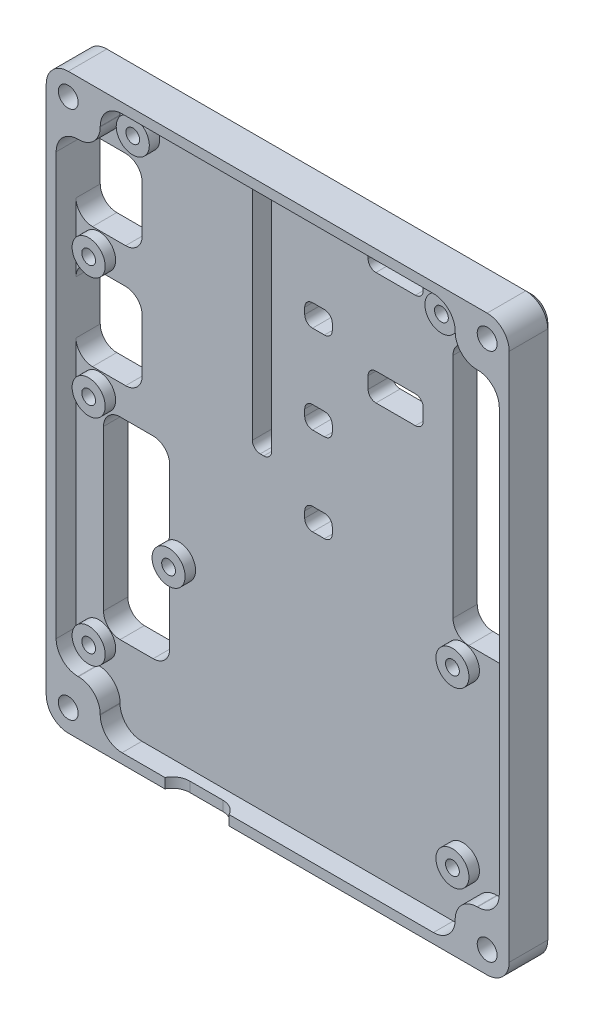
SolidWorks part; units mm, degrees
ref_plane "前视基准面" through (0, 0, 0) normal (0, 0, 1) x (1, 0, 0)
ref_plane "上视基准面" through (0, 0, 0) normal (0, 1, 0) x (1, 0, 0)
ref_plane "右视基准面" through (0, 0, 0) normal (1, 0, 0) x (0, 0, -1)
other "Configuration Table"
sketch "草图1" plane through (0, 0, 0) normal (0, 0, 1) x (1, 0, 0)
  line L1 (0, 0) -> (84, 0)
  line L2 (0, 0) -> (0, 104)
  line L3 (0, 104) -> (84, 104)
  line L4 (84, 0) -> (84, 104)
  dimension "D1" = 104
  dimension "D2" = 84
extrude "凸台-拉伸1" add sketch "草图1" along normal blind 8
fillet "圆角1" radius 4 4 edges at (84, 0, 4) (0, 0, 4) (0, 104, 4) (84, 104, 4)
sketch "草图2" plane through (0, 0, 8) normal (0, 0, 1) x (1, 0, 0)
  line L0 (0, 100) -> (0, 4) construction
  line L1 (4, 100) -> (80, 100) construction
  line L2 (4, 100) -> (4, 4) construction
  line L3 (4, 4) -> (80, 4) construction
  line L4 (80, 100) -> (80, 4) construction
  line L5 (4, 0) -> (80, 0) construction
  line L6 (84, 4) -> (84, 100) construction
  line L7 (80, 104) -> (4, 104) construction
  circle A0 centre (4, 100) radius 1.8
  circle A1 centre (80, 100) radius 1.8
  circle A2 centre (80, 4) radius 1.8
  circle A3 centre (4, 4) radius 1.8
  dimension "D1" = 3.6
  dimension "D2" = 3.6
  dimension "D3" = 3.6
  dimension "D4" = 3.6
  dimension "D5" = 4
  dimension "D6" = 4
  dimension "D7" = 4
  dimension "D8" = 4
  dimension "D9" = 96
  dimension "D10" = 76
extrude "切除-拉伸1" cut sketch "草图2" against normal through all
sketch "草图3" plane through (0, 0, 8) normal (0, 0, 1) x (1, 0, 0)
  line L0 (0, 100) -> (0, 4) construction
  line L1 (2, 2) -> (82, 2) construction
  line L2 (2, 2) -> (2, 102) construction
  line L3 (2, 102) -> (82, 102) construction
  line L4 (82, 2) -> (82, 102) construction
  line L5 (4, 0) -> (80, 0) construction
  circle A0 centre (6, 14) radius 1.25
  circle A1 centre (6, 53) radius 1.25
  circle A2 centre (6, 75) radius 1.25
  circle A3 centre (14, 98) radius 1.25
  circle A4 centre (70, 98) radius 1.25
  circle A5 centre (72, 43.5) radius 1.25
  circle A6 centre (72, 12) radius 1.25
  circle A7 centre (20.5, 33.5) radius 1.25
  dimension "D19" = 2.5
  dimension "D20" = 2.5
  dimension "D21" = 2.5
  dimension "D22" = 2.5
  dimension "D23" = 2.5
  dimension "D24" = 2.5
  dimension "D25" = 2.5
  dimension "D28" = 2.5
  dimension "D1" = 2
  dimension "D2" = 80
  dimension "D3" = 100
  dimension "D4" = 2
  dimension "D5" = 4
  dimension "D6" = 12
  dimension "D7" = 4
  dimension "D8" = 51
  dimension "D9" = 12
  dimension "D10" = 96
  dimension "D11" = 4
  dimension "D12" = 73
  dimension "D13" = 96
  dimension "D14" = 68
  dimension "D15" = 70
  dimension "D16" = 41.5
  dimension "D17" = 70
  dimension "D18" = 10
  dimension "D26" = 18.5
  dimension "D27" = 31.5
extrude "切除-拉伸2" cut sketch "草图3" against normal blind 7
chamfer "倒角1" distance 1 angle 45 8 edges at (82.8284, 1.1716, 0) (42, 0, 0) (1.1716, 1.1716, 0) (0, 52, 0) (1.1716, 102.8284, 0) (42, 104, 0) (84, 52, 0) (82.8284, 102.8284, 0)
sketch "草图5" plane through (0, 0, 8) normal (0, 0, 1) x (1, 0, 0)
  line L0 (0, 100) -> (0, 4) construction
  line L1 (13.75, 1.8) -> (70.25, 1.8)
  line L2 (1.8, 13.75) -> (1.8, 90.25)
  line L3 (13.75, 102.2) -> (70.25, 102.2)
  line L4 (82.2, 13.75) -> (82.2, 90.25)
  line L5 (84, 4) -> (84, 100) construction
  line L6 (80, 104) -> (4, 104) construction
  line L7 (4, 0) -> (80, 0) construction
  line L8 (78.15, 94.2) -> (78.25, 94.2)
  line L9 (5.75, 9.8) -> (5.85, 9.8)
  line L10 (9.8, 5.75) -> (9.8, 5.85)
  line L11 (5.75, 94.2) -> (5.85, 94.2)
  line L12 (74.2, 5.75) -> (74.2, 5.85)
  line L13 (9.8, 98.15) -> (9.8, 98.25)
  line L14 (74.2, 98.15) -> (74.2, 98.25)
  line L15 (78.15, 9.8) -> (78.25, 9.8)
  arc A0 (1.8, 13.75) -> (5.75, 9.8) centre (5.75, 13.75) ccw
  arc A1 (5.85, 9.8) -> (9.8, 5.85) centre (5.85, 5.85) cw
  arc A2 (9.8, 5.75) -> (13.75, 1.8) centre (13.75, 5.75) ccw
  arc A3 (70.25, 1.8) -> (74.2, 5.75) centre (70.25, 5.75) ccw
  arc A4 (74.2, 5.85) -> (78.15, 9.8) centre (78.15, 5.85) cw
  arc A5 (78.25, 9.8) -> (82.2, 13.75) centre (78.25, 13.75) ccw
  arc A6 (82.2, 90.25) -> (78.25, 94.2) centre (78.25, 90.25) ccw
  arc A7 (78.15, 94.2) -> (74.2, 98.15) centre (78.15, 98.15) cw
  arc A8 (74.2, 98.25) -> (70.25, 102.2) centre (70.25, 98.25) ccw
  arc A9 (1.8, 90.25) -> (5.75, 94.2) centre (5.75, 90.25) cw
  arc A10 (5.85, 94.2) -> (9.8, 98.15) centre (5.85, 98.15) ccw
  arc A11 (9.8, 98.25) -> (13.75, 102.2) centre (13.75, 98.25) cw
  point P30 (74.2, 9.8)
  point P37 (74.2, 94.2)
  point P44 (9.8, 94.2)
  dimension "D9" = 3.95
  dimension "D1" = 1.8
  dimension "D2" = 1.8
  dimension "D3" = 1.8
  dimension "D4" = 1.8
  dimension "D5" = 8
  dimension "D6" = 8
  dimension "D7" = 8
  dimension "D8" = 8
  dimension "D10" = 100.4
extrude "切除-拉伸4" cut sketch "草图5" against normal blind 3.6
sketch "草图7" plane through (0, 0, 4.4) normal (0, 0, 1) x (1, 0, 0)
  circle A0 centre (14, 98) radius 3
  circle A1 centre (14, 98) radius 1.25
  circle A2 centre (70, 98) radius 3
  circle A3 centre (70, 98) radius 1.25
  circle A4 centre (6, 75) radius 3
  circle A5 centre (6, 75) radius 1.25
  circle A6 centre (6, 53) radius 1.25
  circle A7 centre (6, 53) radius 3
  circle A8 centre (6, 14) radius 3
  circle A9 centre (6, 14) radius 1.25
  circle A10 centre (72, 12) radius 1.25
  circle A11 centre (72, 12) radius 3
  circle A12 centre (72, 43.5) radius 1.25
  circle A13 centre (72, 43.5) radius 3
  circle A14 centre (20.5, 33.5) radius 1.25
  circle A15 centre (20.5, 33.5) radius 3
  dimension "D1" = 6
  dimension "D2" = 2.5
  dimension "D3" = 2.5
  dimension "D4" = 6
  dimension "D5" = 2.5
  dimension "D6" = 6
  dimension "D7" = 2.5
  dimension "D8" = 6
  dimension "D9" = 6
  dimension "D10" = 2.5
  dimension "D11" = 6
  dimension "D12" = 2.5
  dimension "D13" = 2.5
  dimension "D14" = 6
  dimension "D15" = 6
  dimension "D16" = 2.5
extrude "凸台-拉伸2" add sketch "草图7" along normal blind 1.9
sketch "草图8" plane through (0, 0, 4.4) normal (0, 0, 1) x (1, 0, 0)
  line L0 (1.8, 90.25) -> (1.8, 13.75) construction
  line L1 (2.6516, 92.7) -> (10.8, 92.7)
  line L2 (1.8, 90.25) -> (1.8, 81.2)
  line L3 (4.8, 78.2) -> (10.8, 78.2)
  line L4 (13.8, 89.7) -> (13.8, 81.2)
  line L5 (4.8, 71.8) -> (10.8, 71.8)
  line L6 (1.8, 68.8) -> (1.8, 59.2)
  line L7 (4.8, 56.2) -> (10.8, 56.2)
  line L8 (13.8, 68.8) -> (13.8, 59.2)
  line L9 (73.0549, 93.5) -> (79.2714, 93.5)
  line L10 (70.2, 90.6451) -> (70.2, 49.3549)
  line L11 (73.0549, 46.5) -> (79.3451, 46.5)
  line L12 (82.2, 90.25) -> (82.2, 49.3549)
  line L13 (9.8, 50.8) -> (15.8, 50.8)
  line L14 (6.8, 47.8) -> (6.8, 18.8)
  line L15 (9.8, 15.8) -> (15.8, 15.8)
  line L16 (18.8, 47.8) -> (18.8, 35.9718)
  line L17 (13.75, 1.8) -> (70.25, 1.8) construction
  line L18 (18.8, 31.0282) -> (18.8, 18.8)
  line L19 (82.2, 13.75) -> (82.2, 90.25) construction
  circle A0 centre (6, 75) radius 1.25 construction
  circle A1 centre (6, 53) radius 1.25 construction
  arc A2 (2.6516, 92.7) -> (1.8, 90.25) centre (5.75, 90.25) ccw
  arc A3 (15.8, 15.8) -> (18.8, 18.8) centre (15.8, 18.8) ccw
  arc A4 (9.8, 15.8) -> (6.8, 18.8) centre (9.8, 18.8) cw
  arc A5 (15.8, 50.8) -> (18.8, 47.8) centre (15.8, 47.8) cw
  arc A6 (1.8, 59.2) -> (4.8, 56.2) centre (4.8, 59.2) ccw
  arc A7 (10.8, 56.2) -> (13.8, 59.2) centre (10.8, 59.2) ccw
  arc A8 (13.8, 68.8) -> (10.8, 71.8) centre (10.8, 68.8) ccw
  arc A9 (1.8, 68.8) -> (4.8, 71.8) centre (4.8, 68.8) cw
  arc A10 (1.8, 81.2) -> (4.8, 78.2) centre (4.8, 81.2) ccw
  arc A11 (10.8, 78.2) -> (13.8, 81.2) centre (10.8, 81.2) ccw
  arc A12 (13.8, 89.7) -> (10.8, 92.7) centre (10.8, 89.7) ccw
  arc A13 (18.8, 35.9718) -> (18.8, 31.0282) centre (20.5, 33.5) ccw
  arc A14 (6.8, 47.8) -> (9.8, 50.8) centre (9.8, 47.8) cw
  circle A15 centre (72, 43.5) radius 1.25 construction
  circle A16 centre (70, 98) radius 1.25 construction
  arc A17 (82.2, 90.25) -> (81.9339, 91.6752) centre (78.25, 90.25) ccw
  arc A18 (70.2, 90.6451) -> (73.0549, 93.5) centre (73.0549, 90.6451) cw
  arc A19 (79.2714, 93.5) -> (81.9339, 91.6752) centre (79.2714, 90.6451) cw
  arc A20 (82.2, 49.3549) -> (79.3451, 46.5) centre (79.3451, 49.3549) cw
  arc A21 (73.0549, 46.5) -> (70.2, 49.3549) centre (73.0549, 49.3549) cw
  point P45 (13.8, 78.2)
  point P48 (13.8, 92.7)
  dimension "D11" = 3
  dimension "D12" = 6
  dimension "D13" = 3
  dimension "D17" = 2.8549
  dimension "D1" = 17
  dimension "D2" = 5
  dimension "D3" = 14
  dimension "D4" = 35
  dimension "D5" = 12
  dimension "D6" = 3.2
  dimension "D7" = 3.2
  dimension "D8" = 12
  dimension "D9" = 3.2
  dimension "D10" = 14.5
  dimension "D14" = 12
  dimension "D15" = 3
  dimension "D16" = 4.5
extrude "切除-拉伸5" cut sketch "草图8" against normal through all
sketch "草图9" plane through (0, 0, 4.4) normal (0, 0, 1) x (1, 0, 0)
  line L0 (1.8, 81.2) -> (1.8, 68.8) construction
  line L1 (35.2242, 100.7) -> (35.8758, 100.7)
  line L2 (33.8, 99.2758) -> (33.8, 59.1242)
  line L3 (35.2242, 57.7) -> (35.8758, 57.7)
  line L4 (37.3, 99.2758) -> (37.3, 59.1242)
  line L5 (56.2242, 101.7) -> (63.3758, 101.7)
  line L6 (54.8, 100.2758) -> (54.8, 98.1242)
  line L7 (56.2242, 96.7) -> (63.3758, 96.7)
  line L8 (64.8, 100.2758) -> (64.8, 98.1242)
  line L9 (56.2242, 81.2) -> (63.3758, 81.2)
  line L10 (54.8, 79.7758) -> (54.8, 77.6242)
  line L11 (56.2242, 76.2) -> (63.3758, 76.2)
  line L12 (64.8, 79.7758) -> (64.8, 77.6242)
  line L17 (44.7242, 86.2) -> (46.8758, 86.2)
  line L18 (43.3, 84.7758) -> (43.3, 83.6242)
  line L19 (44.7242, 82.2) -> (46.8758, 82.2)
  line L20 (48.3, 84.7758) -> (48.3, 83.6242)
  line L21 (44.7242, 70.2) -> (46.8758, 70.2)
  line L22 (43.3, 68.7758) -> (43.3, 67.6242)
  line L23 (44.7242, 66.2) -> (46.8758, 66.2)
  line L24 (48.3, 68.7758) -> (48.3, 67.6242)
  line L25 (44.7242, 54.2) -> (46.8758, 54.2)
  line L26 (43.3, 52.7758) -> (43.3, 51.6242)
  line L27 (44.7242, 50.2) -> (46.8758, 50.2)
  line L28 (48.3, 52.7758) -> (48.3, 51.6242)
  line L29 (70.25, 102.2) -> (13.75, 102.2) construction
  line L30 (1.8, 59.2) -> (1.8, 13.75) construction
  arc A0 (56.2242, 96.7) -> (54.8, 98.1242) centre (56.2242, 98.1242) cw
  arc A1 (54.8, 100.2758) -> (56.2242, 101.7) centre (56.2242, 100.2758) cw
  arc A2 (64.8, 98.1242) -> (63.3758, 96.7) centre (63.3758, 98.1242) cw
  arc A3 (64.8, 100.2758) -> (63.3758, 101.7) centre (63.3758, 100.2758) ccw
  arc A4 (48.3, 83.6242) -> (46.8758, 82.2) centre (46.8758, 83.6242) cw
  arc A5 (44.7242, 82.2) -> (43.3, 83.6242) centre (44.7242, 83.6242) cw
  arc A6 (43.3, 84.7758) -> (44.7242, 86.2) centre (44.7242, 84.7758) cw
  arc A7 (48.3, 84.7758) -> (46.8758, 86.2) centre (46.8758, 84.7758) ccw
  arc A8 (56.2242, 81.2) -> (54.8, 79.7758) centre (56.2242, 79.7758) ccw
  arc A9 (54.8, 77.6242) -> (56.2242, 76.2) centre (56.2242, 77.6242) ccw
  arc A10 (63.3758, 76.2) -> (64.8, 77.6242) centre (63.3758, 77.6242) ccw
  arc A11 (63.3758, 81.2) -> (64.8, 79.7758) centre (63.3758, 79.7758) cw
  arc A12 (46.8758, 54.2) -> (48.3, 52.7758) centre (46.8758, 52.7758) cw
  arc A13 (48.3, 51.6242) -> (46.8758, 50.2) centre (46.8758, 51.6242) cw
  arc A14 (44.7242, 50.2) -> (43.3, 51.6242) centre (44.7242, 51.6242) cw
  arc A15 (43.3, 52.7758) -> (44.7242, 54.2) centre (44.7242, 52.7758) cw
  arc A16 (46.8758, 66.2) -> (48.3, 67.6242) centre (46.8758, 67.6242) ccw
  arc A17 (48.3, 68.7758) -> (46.8758, 70.2) centre (46.8758, 68.7758) ccw
  arc A18 (43.3, 68.7758) -> (44.7242, 70.2) centre (44.7242, 68.7758) cw
  arc A19 (43.3, 67.6242) -> (44.7242, 66.2) centre (44.7242, 67.6242) ccw
  arc A20 (37.3, 59.1242) -> (35.8758, 57.7) centre (35.8758, 59.1242) cw
  arc A21 (35.2242, 57.7) -> (33.8, 59.1242) centre (35.2242, 59.1242) cw
  arc A22 (35.8758, 100.7) -> (37.3, 99.2758) centre (35.8758, 99.2758) cw
  arc A23 (33.8, 99.2758) -> (35.2242, 100.7) centre (35.2242, 99.2758) cw
  point P14 (54.8, 96.7)
  point P37 (64.8, 96.7)
  point P40 (64.8, 101.7)
  point P43 (48.3, 82.2)
  point P46 (43.3, 82.2)
  point P53 (54.8, 81.2)
  point P58 (64.8, 76.2)
  point P61 (64.8, 81.2)
  point P64 (48.3, 54.2)
  point P67 (48.3, 50.2)
  point P70 (43.3, 50.2)
  point P75 (48.3, 66.2)
  point P78 (48.3, 70.2)
  point P83 (43.3, 66.2)
  point P88 (33.8, 57.7)
  point P93 (33.8, 100.7)
  dimension "D25" = 1.4242
  dimension "D1" = 32
  dimension "D2" = 3.5
  dimension "D3" = 1.5
  dimension "D4" = 43
  dimension "D5" = 16
  dimension "D6" = 4
  dimension "D7" = 41.5
  dimension "D8" = 5
  dimension "D9" = 41.5
  dimension "D10" = 41.5
  dimension "D11" = 5
  dimension "D12" = 5
  dimension "D13" = 32
  dimension "D14" = 4
  dimension "D15" = 48
  dimension "D16" = 4
  dimension "D17" = 0.5
  dimension "D18" = 10
  dimension "D19" = 53
  dimension "D20" = 5
  dimension "D21" = 53
  dimension "D22" = 10
  dimension "D23" = 21
  dimension "D24" = 5
extrude "切除-拉伸6" cut sketch "草图9" against normal through all
sketch "草图11" plane through (0, 0, 0) normal (0, -1, 0) x (1, 0, 0)
  line L0 (24.35, 9.5) -> (30.35, 9.5) construction
  line L1 (24.35, 12.7) -> (30.35, 12.7)
  line L2 (24.35, 6.3) -> (30.35, 6.3)
  line L3 (4, 8) -> (80, 8) construction
  line L4 (0, 1) -> (0, 8) construction
  arc A0 (24.35, 12.7) -> (24.35, 6.3) centre (24.35, 9.5) ccw
  arc A1 (30.35, 6.3) -> (30.35, 12.7) centre (30.35, 9.5) ccw
  point P2 (27.35, 9.5)
  dimension "D1" = 1.5
  dimension "D2" = 6.4
  dimension "D3" = 6
  dimension "D4" = 27.35
extrude "切除-拉伸7" cut sketch "草图11" against normal blind 2
fillet "圆角2" radius 1.5 3 edges at (18.8, 31.0282, 2.2) (18.8, 35.9718, 2.2) (2.6516, 92.7, 2.2)
